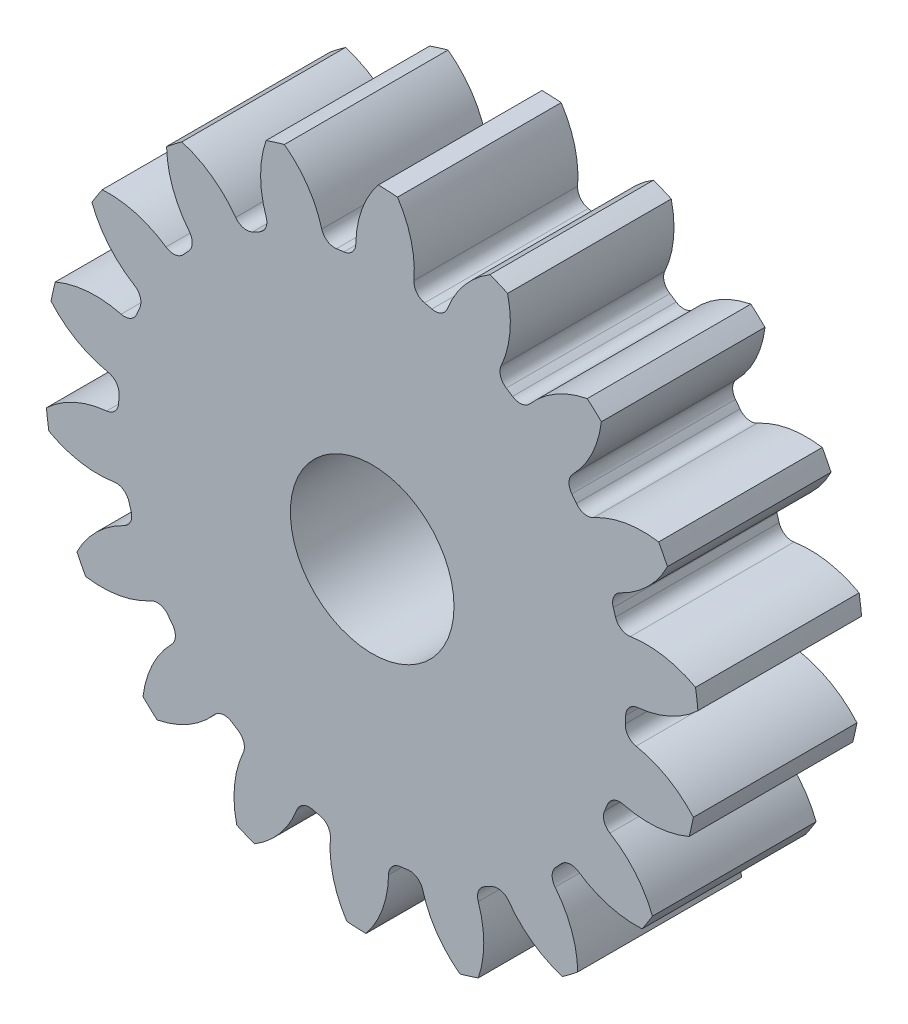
SolidWorks part; units mm, degrees
ref_plane "Front" through (0, 0, 0) normal (0, 0, 1) x (1, 0, 0)
ref_plane "Top" through (0, 0, 0) normal (0, 1, 0) x (1, 0, 0)
ref_plane "Right" through (0, 0, 0) normal (1, 0, 0) x (0, 0, -1)
sketch "Sketch3" plane through (0, 0, 0) normal (0, 0, 1) x (1, 0, 0)
  circle A0 centre (0, 0) radius 203.2
  dimension "od" = 406.4
extrude "gearBody" add sketch "Sketch3" along normal blind 101.6
sketch "Sketch2" plane through (0, 0, 0) normal (0, 0, 1) x (1, 0, 0)
  line L0 (0, 0) -> (158.7696, 65.7645) construction
  line L1 (200.2723, -40.0632) -> (0, 0) construction
  line L2 (0, 0) -> (36.3143, 0) construction
  line L3 (182.7418, 7.1096) -> (181.2073, -24.6779) construction
  line L5 (181.9745, -8.7841) -> (0, 0) construction
  line L7 (0, 0) -> (171.851, 0) construction
  arc A0 (171.8099, 3.7564) -> (170.6493, -20.2873) centre (0, 0) ccw construction
  arc A1 (202.2459, 19.6682) -> (199.4112, -39.0566) centre (0, 0) ccw construction
  arc A2 (182.7418, 7.1096) -> (181.2073, -24.6779) centre (0, 0) ccw construction
  arc A3 (157.1671, -9.9222) -> (157.3921, -5.262) centre (0, 0) ccw
  arc A4 (200.2723, -40.0632) -> (163.8365, -18.5603) centre (151.6971, -80.7511) ccw
  arc A5 (200.2723, -40.0632) -> (203.2, 20.5871) centre (0, 0) ccw
  arc A6 (203.2, 20.5871) -> (164.8625, 2.6936) centre (158.7696, 65.7645) cw
  arc A7 (157.3921, -5.262) -> (164.8625, 2.6936) centre (165.6577, -5.5383) cw
  arc A8 (163.8365, -18.5603) -> (157.1671, -9.9222) centre (165.4209, -10.4433) cw
  point P6 (203.2, 20.5871)
  point P22 (200.2723, -40.0632)
  dimension "baseDia" = 343.702
  dimension "od" = 406.4
  dimension "pd" = 365.76
  dimension "rd" = 314.96
  dimension "rFillet" = 8.2702
  dimension "pointX" = 203.2
  dimension "pointY" = 20.5871
  dimension "CTT" = 31.7875
  dimension "flankCenterAngle" = 22.5
extrude "toothCut" cut sketch "Sketch2" along normal through all
pattern_circular "CirPattern1" count 18 over 360 about axis through (0, 0, 0) along (0, 0, 1) of "toothCut"
sketch "hub1Dia" plane through (0, 0, 0) normal (0, 0, -1) x (-1, 0, 0)
  circle A0 centre (0, 0) radius 12.7
  dimension "hub1Dia" = 25.4
sketch "hub2Dia" plane through (0, 0, 101.6) normal (0, 0, 1) x (1, 0, 0)
  circle A0 centre (0, 0) radius 12.7
  dimension "hub2dia" = 25.4
sketch "boreDia" plane through (0, 0, 0) normal (0, 0, 1) x (1, 0, 0)
  circle A0 centre (0, 0) radius 50.8
  dimension "boreDia" = 101.6
extrude "bore" cut sketch "boreDia" against normal mid plane 25400
